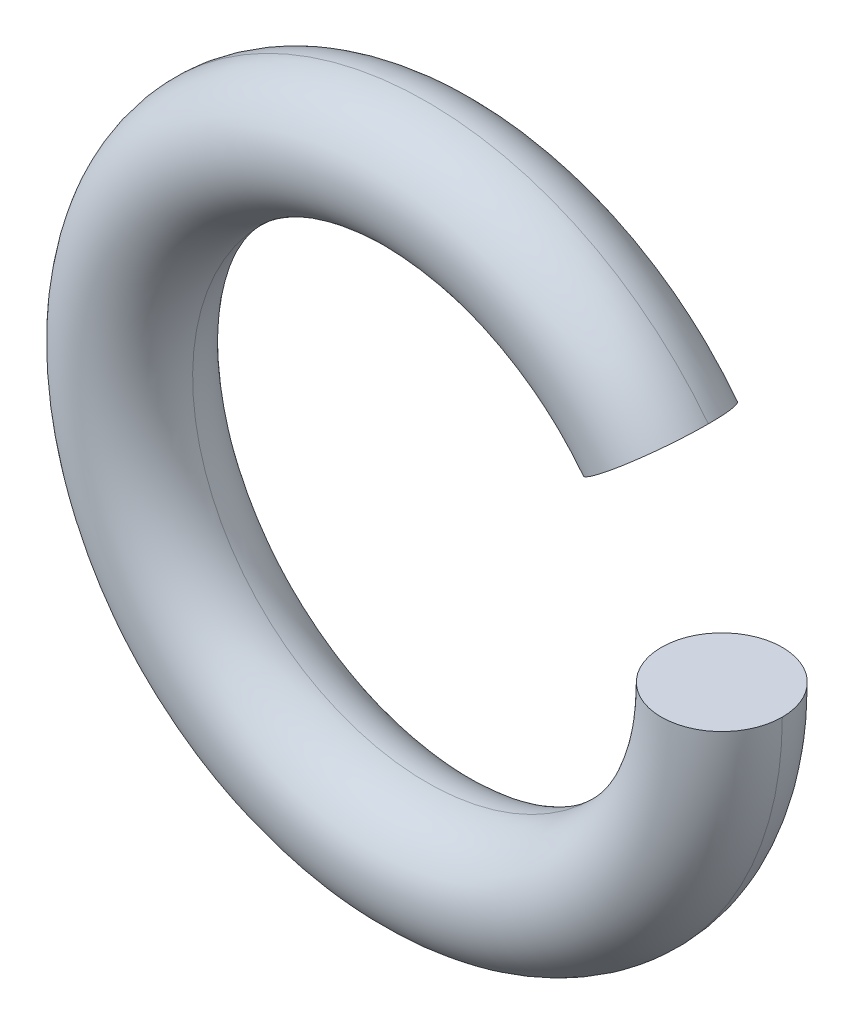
SolidWorks part; units mm, degrees
ref_plane "Front" through (0, 0, 0) normal (0, 0, 1) x (1, 0, 0)
ref_plane "Top" through (0, 0, 0) normal (0, 1, 0) x (1, 0, 0)
ref_plane "Right" through (0, 0, 0) normal (1, 0, 0) x (0, 0, -1)
other "Configuration Table"
sketch "Sketch1" plane through (0, 0, 0) normal (0, 0, 1) x (1, 0, 0)
  line L0 (-76.5339, 0) -> (24.9274, 0) construction
  line L1 (0, 65.6634) -> (0, -53.6178) construction
  line L2 (0, 0) -> (2.5652, 1.9782) construction
  arc A0 (1.2274, 0.9465) -> (1.55, 0) centre (0, 0) ccw
  dimension "d2" = 3.1
  dimension "e" = 1
sketch "Sketch2" plane through (0, 0, 0) normal (0, 1, 0) x (1, 0, 0)
  circle A0 centre (1.95, 0) radius 0.4
  point P2 (1.55, 0)
  dimension "d4" = 0.8
sweep "Sweep1" add profiles "Sketch2" path "Sketch1"
